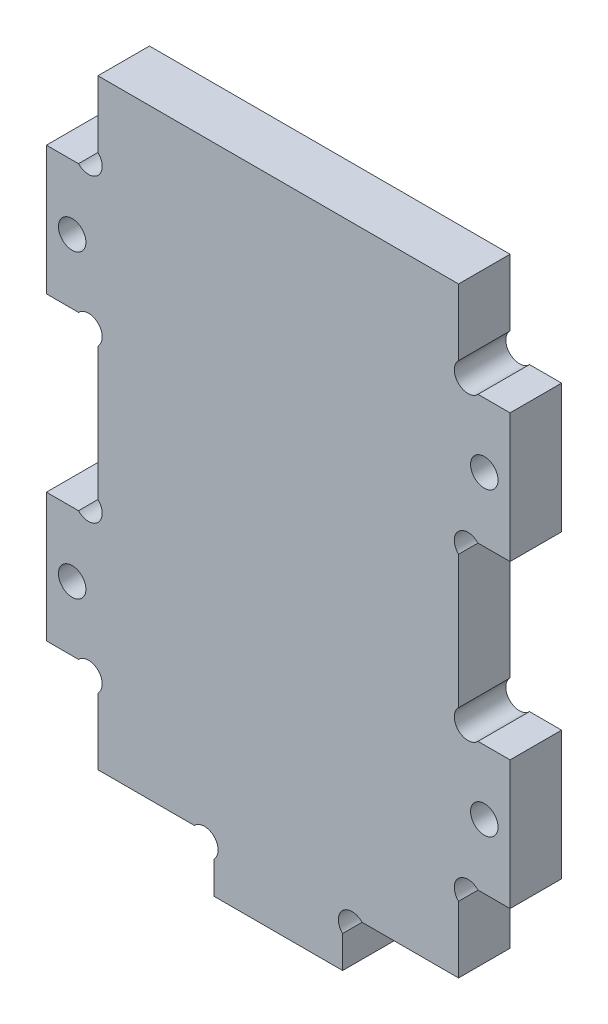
SolidWorks part; units mm, degrees
ref_plane "Plan de face" through (0, 0, 0) normal (0, 0, 1) x (1, 0, 0)
ref_plane "Plan de dessus" through (0, 0, 0) normal (0, 1, 0) x (1, 0, 0)
ref_plane "Plan de droite" through (0, 0, 0) normal (1, 0, 0) x (0, 0, -1)
sketch "Esquisse1" plane through (0, 0, 0) normal (0, 0, 1) x (1, 0, 0)
  line L0 (0, 85.0119) -> (0, -48.1448) construction
  line L1 (-4.9076, 0) -> (60.9214, 0) construction
  line L2 (-10.3228, 70) -> (57.7061, 70) construction
  line L3 (21, 85.0119) -> (21, -9.0902) construction
  line L4 (27, 85.0119) -> (27, -9.0902) construction
  line L5 (15.925, 60) -> (33.2032, 60) construction
  line L6 (16.7611, 45) -> (38.9161, 45) construction
  line L7 (16.7611, 10) -> (40.7276, 10) construction
  line L8 (16.7611, 25) -> (47.8339, 25) construction
  line L9 (-21, 70) -> (21, 70)
  line L10 (21, 70) -> (21, 62.2619)
  line L11 (23.2619, 60) -> (27, 60)
  line L12 (27, 60) -> (27, 45)
  line L13 (27, 45) -> (23.2619, 45)
  line L14 (21, 42.7381) -> (21, 27.2619)
  line L15 (23.2619, 25) -> (27, 25)
  line L16 (27, 25) -> (27, 10)
  line L17 (27, 10) -> (23.2619, 10)
  line L18 (21, 7.7381) -> (21, 0)
  line L19 (-4.9076, -6) -> (34.1786, -6) construction
  line L20 (7.5, 3.5643) -> (7.5, -24.4423) construction
  line L21 (7.5, -2.2619) -> (7.5, -6)
  line L22 (7.5, -6) -> (-7.5, -6)
  line L23 (9.7619, 0) -> (21, 0)
  line L24 (-7.5, -2.2619) -> (-7.5, -6)
  line L25 (-9.7619, 0) -> (-21, 0)
  line L26 (-21, 7.7381) -> (-21, 0)
  line L27 (-27, 10) -> (-23.2619, 10)
  line L28 (-27, 25) -> (-27, 10)
  line L29 (-23.2619, 25) -> (-27, 25)
  line L30 (-21, 42.7381) -> (-21, 27.2619)
  line L31 (-27, 45) -> (-23.2619, 45)
  line L32 (-27, 60) -> (-27, 45)
  line L33 (-23.2619, 60) -> (-27, 60)
  line L34 (-21, 70) -> (-21, 62.2619)
  arc A0 (21, 62.2619) -> (23.2619, 60) centre (22.1, 61.1) ccw
  arc A1 (23.2619, 45) -> (21, 42.7381) centre (22.1, 43.9) ccw
  arc A2 (21, 27.2619) -> (23.2619, 25) centre (22.1, 26.1) ccw
  arc A3 (23.2619, 10) -> (21, 7.7381) centre (22.1, 8.9) ccw
  arc A4 (9.7619, 0) -> (7.5, -2.2619) centre (8.6, -1.1) ccw
  arc A5 (-9.7619, 0) -> (-7.5, -2.2619) centre (-8.6, -1.1) cw
  arc A6 (-23.2619, 10) -> (-21, 7.7381) centre (-22.1, 8.9) cw
  arc A7 (-21, 27.2619) -> (-23.2619, 25) centre (-22.1, 26.1) cw
  arc A8 (-23.2619, 45) -> (-21, 42.7381) centre (-22.1, 43.9) cw
  arc A9 (-21, 62.2619) -> (-23.2619, 60) centre (-22.1, 61.1) cw
  circle A10 centre (24, 52.5) radius 1.6
  circle A11 centre (24, 17.5) radius 1.6
  circle A12 centre (-24, 52.5) radius 1.6
  circle A13 centre (-24, 17.5) radius 1.6
  point P63 (0, -6)
  point P69 (0, 70)
  dimension "D9" = 1.1
  dimension "D11" = 1.1
  dimension "D12" = 1.1
  dimension "D16" = 3
  dimension "D18" = 7.5
  dimension "D1" = 21
  dimension "D2" = 6
  dimension "D3" = 10
  dimension "D4" = 15
  dimension "D5" = 10
  dimension "D6" = 15
  dimension "D7" = 6
  dimension "D8" = 7.5
  dimension "D10" = 1.1
  dimension "D13" = 1.1
  dimension "D14" = 1.1
  dimension "D15" = 1.1
  dimension "D17" = 7.5
extrude "Extrusion1" add sketch "Esquisse1" along normal blind 6
